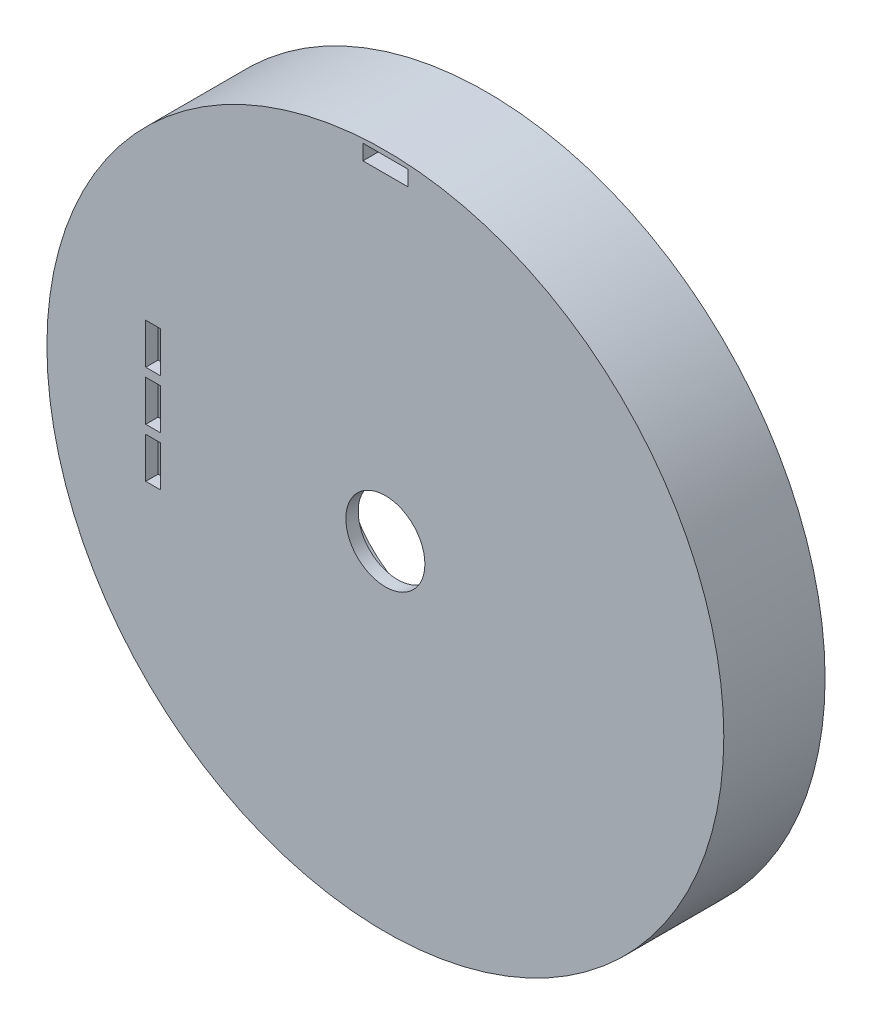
SolidWorks part; units mm, degrees
ref_plane "Přední rovina" through (0, 0, 0) normal (0, 0, 1) x (1, 0, 0)
ref_plane "Horní rovina" through (0, 0, 0) normal (0, 1, 0) x (1, 0, 0)
ref_plane "Pravá rovina" through (0, 0, 0) normal (1, 0, 0) x (0, 0, -1)
sketch "Skica1" plane through (0, 0, 0) normal (0, 0, 1) x (1, 0, 0)
  circle A0 centre (0, 0) radius 16
  circle A1 centre (0, 0) radius 137
  dimension "D1" = 32
  dimension "D2" = 274
extrude "Přidat vysunutím1" add sketch "Skica1" along normal blind 5
sketch "Skica4" plane through (0, 0, 0) normal (0, 0, -1) x (-1, 0, 0)
  circle A0 centre (0, 0) radius 137
  circle A1 centre (0, 0) radius 122.5
  dimension "D1" = 245
  dimension "D2" = 274
extrude "Přidat vysunutím2" add sketch "Skica4" along normal blind 36
sketch "Skica7" plane through (0, 0, 0) normal (0, 0, 1) x (1, 0, 0)
  line L0 (0, 137) -> (0, -137) construction
  line L1 (-137, 0) -> (137, 0) construction
  line L2 (-9.07, 135) -> (9.07, 135)
  line L3 (9.07, 135) -> (9.07, 128.81)
  line L4 (-9.07, 135) -> (-9.07, 128.81)
  line L5 (-9.07, 128.81) -> (9.07, 128.81)
  circle A0 centre (0, 0) radius 137 construction
  circle A1 centre (0, 0) radius 135 construction
  point P14 (0, 135)
  dimension "D1" = 9.07
  dimension "D2" = 6.19
  dimension "D3" = 135
extrude "Odebrat vysunutím3" cut sketch "Skica7" against normal blind 73.7 and the other way blind 33.7
sketch "Skica10" plane through (0, 0, 5) normal (0, 0, 1) x (1, 0, 0)
  line L0 (0, 137) -> (0, 0) construction
  line L1 (-97, 0) -> (-97, -7.5)
  line L2 (-97, 29) -> (-97, 0)
  line L3 (0, 0) -> (-91, 0) construction
  line L4 (-91, 29) -> (-91, 0)
  line L5 (-91, 29) -> (-97, 29)
  line L6 (-97, 12.5) -> (-91, 12.5)
  line L7 (-97, 9) -> (-91, 9)
  line L8 (-97, -7.5) -> (-91, -7.5)
  line L9 (-91, -7.5) -> (-91, 0)
  line L10 (-97, -7.5) -> (-97, -11)
  line L11 (-97, -11) -> (-97, -27.5)
  line L12 (-97, -27.5) -> (-91, -27.5)
  line L13 (-91, -27.5) -> (-91, -11)
  line L14 (-91, -11) -> (-97, -11)
  line L15 (-91, -7.5) -> (-91, -11)
  circle A0 centre (0, 0) radius 137 construction
  point P9 (-97, 12.5)
  point P13 (-97, 9)
  point P14 (-97, 12.5)
  dimension "D1" = 97
  dimension "D2" = 29
  dimension "D3" = 91
  dimension "D4" = 16.5
  dimension "D5" = 3.5
  dimension "D6" = 16.5
  dimension "D7" = 3.5
  dimension "D8" = 16.5
  dimension "D9" = 6
extrude "Odebrat vysunutím4" cut sketch "Skica10" against normal blind 30 contours L13 L14 L11 L12 | L8 L9 L4 L7 L2 L1 | L2 L6 L4 L5
sketch "Skica11" plane through (0, 0, -36) normal (0, 0, -1) x (-1, 0, 0)
  circle A0 centre (0, 0) radius 122.5
  circle A1 centre (0, 0) radius 126.5
  dimension "D1" = 253
  dimension "D2" = 245
extrude "Přidat vysunutím3" add sketch "Skica11" along normal blind 4.7023
sketch "Skica12" plane through (0, 0, 0) normal (0, 0, -1) x (-1, 0, 0)
  circle A0 centre (0, 0) radius 40
  circle A1 centre (0, 0) radius 45
  dimension "D1" = 80
  dimension "D2" = 90
extrude "Přidat vysunutím4" add sketch "Skica12" along normal blind 18
sketch "Skica13" plane through (0, 0, -18) normal (0, 0, -1) x (-1, 0, 0)
  circle A0 centre (0, 0) radius 45
  circle A1 centre (0, 0) radius 25
  dimension "D1" = 90
  dimension "D2" = 50
extrude "Přidat vysunutím6" [suppressed] add sketch "Skica13" along normal blind 5
scale "Měřítko1" scale about origin uniform scaling yes scale factor 0.655
